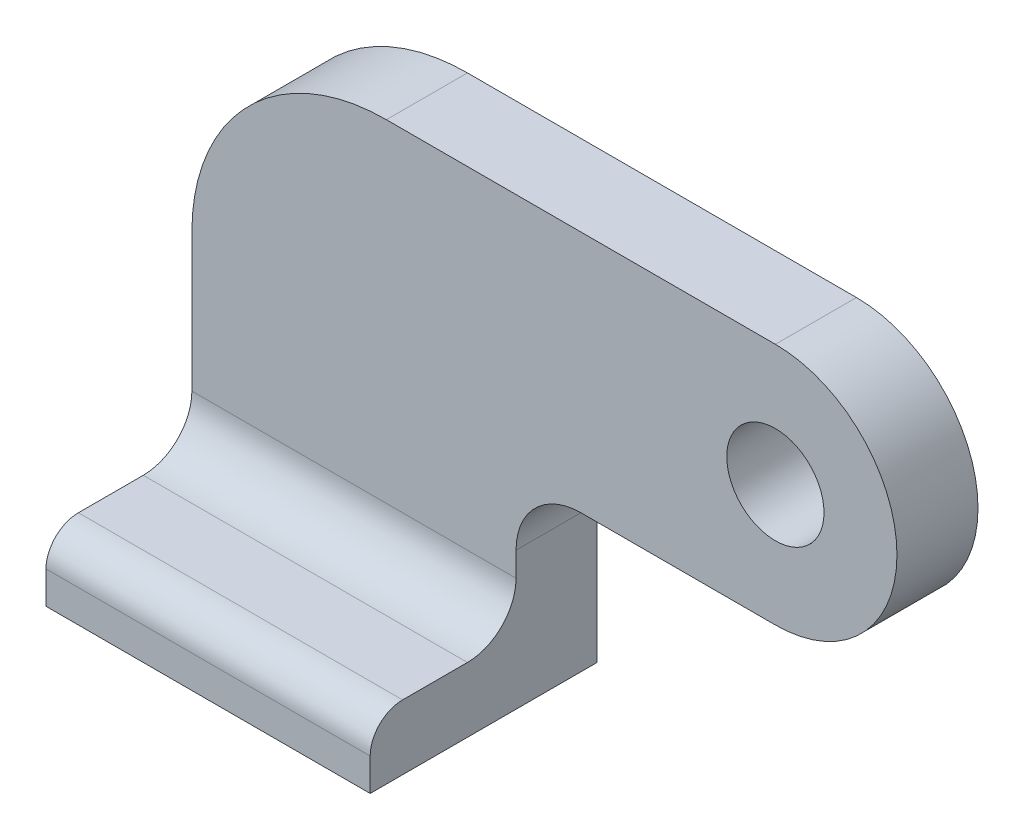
SolidWorks part; units mm, degrees
ref_plane "Front" through (0, 0, 0) normal (0, 0, 1) x (1, 0, 0)
ref_plane "Top" through (0, 0, 0) normal (0, 1, 0) x (1, 0, 0)
ref_plane "Right" through (0, 0, 0) normal (1, 0, 0) x (0, 0, -1)
sketch "Sketch2" plane through (0, 0, 0) normal (0, 0, 1) x (1, 0, 0)
  line L1 (0, 0) -> (63.5, 0)
  line L2 (0, 0) -> (0, 49.2125)
  line L3 (38.1, 87.3125) -> (114.3, 87.3125)
  line L5 (76.2, 39.6875) -> (114.3, 39.6875)
  line L6 (63.5, 26.9875) -> (63.5, 0)
  arc A0 (114.3, 87.3125) -> (114.3, 39.6875) centre (114.3, 63.5) cw
  circle A1 centre (114.3, 63.5) radius 9.525
  arc A2 (63.5, 26.9875) -> (76.2, 39.6875) centre (76.2, 26.9875) cw
  arc A3 (38.1, 87.3125) -> (0, 49.2125) centre (38.1, 49.2125) ccw
  dimension "D2" = 19.05
  dimension "D3" = 63.5
  dimension "D6" = 12.7
  dimension "D7" = 38.1
  dimension "D1" = 47.625
  dimension "D4" = 63.5
  dimension "D5" = 50.8
extrude "Base-Extrude" add sketch "Sketch2" against normal blind 15.875
sketch "Sketch3" plane through (0, 0, -15.875) normal (0, 0, -1) x (-1, 0, 0)
  line L0 (-63.5, 0) -> (-63.5, 26.9875) construction
  line L1 (0, 0) -> (-63.5, 0)
  line L2 (0, 0) -> (0, 12.7)
  line L3 (0, 12.7) -> (-63.5, 12.7)
  line L4 (-63.5, 0) -> (-63.5, 12.7)
  dimension "D1" = 12.7
extrude "Boss-Extrude1" add sketch "Sketch3" against normal blind 44.45
fillet "Fillet1" radius 6.35 1 edges at (31.75, 12.7, 28.575)
fillet "Fillet2" radius 9.525 1 edges at (31.75, 12.7, 0)
